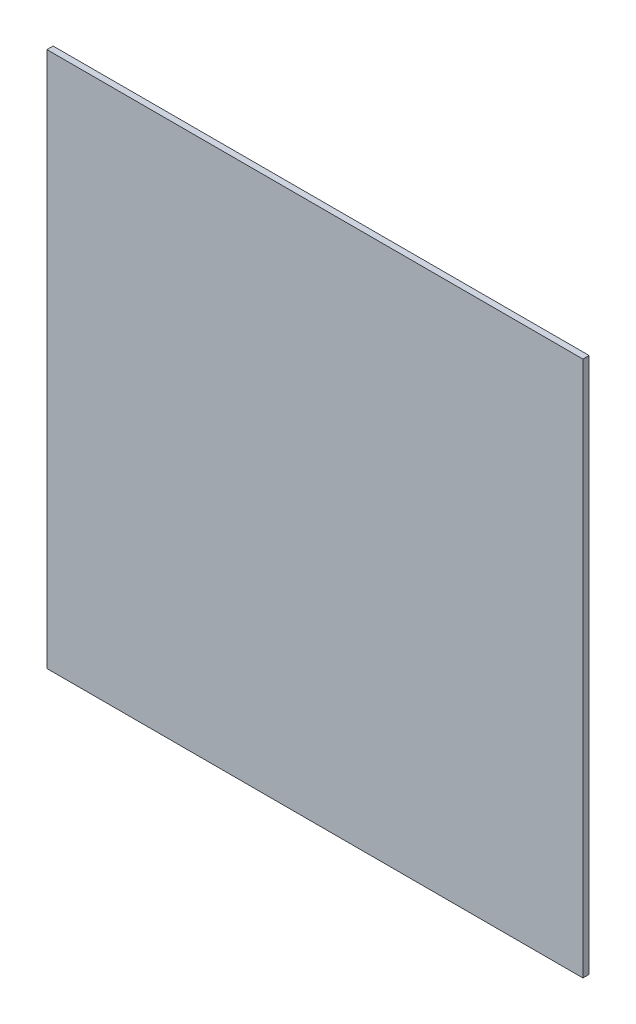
SolidWorks part; units mm, degrees
ref_plane "Plan de face" through (0, 0, 0) normal (0, 0, 1) x (1, 0, 0)
ref_plane "Plan de dessus" through (0, 0, 0) normal (0, 1, 0) x (1, 0, 0)
ref_plane "Plan de droite" through (0, 0, 0) normal (1, 0, 0) x (0, 0, -1)
sketch "Esquisse1" plane through (0, 0, 0) normal (0, 0, 1) x (1, 0, 0)
  line L1 (-129.8, -129.8) -> (129.8, -129.8)
  line L2 (-129.8, -129.8) -> (-129.8, 129.8)
  line L3 (-129.8, 129.8) -> (129.8, 129.8)
  line L4 (129.8, -129.8) -> (129.8, 129.8)
  line L5 (-129.8, -129.8) -> (129.8, 129.8) construction
  line L6 (-129.8, 129.8) -> (129.8, -129.8) construction
  point P0 (0, 0)
extrude "Boss.-Extru.1" add sketch "Esquisse1" along normal blind 3
